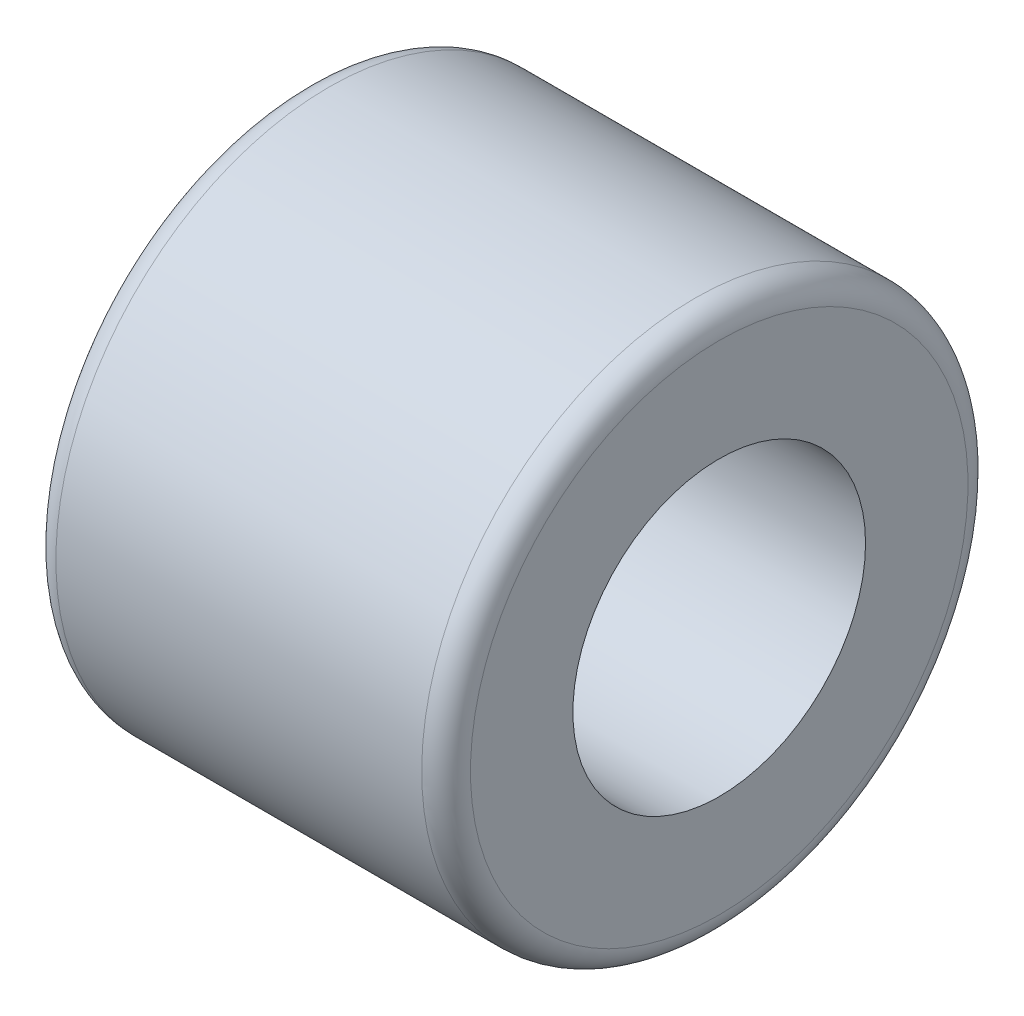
SolidWorks part; units mm, degrees
ref_plane "Plan de face" through (0, 0, 0) normal (0, 0, 1) x (1, 0, 0)
ref_plane "Plan de dessus" through (0, 0, 0) normal (0, 1, 0) x (1, 0, 0)
ref_plane "Plan de droite" through (0, 0, 0) normal (1, 0, 0) x (0, 0, -1)
sketch "Esquisse1" plane through (0, 0, 0) normal (0, 0, 1) x (1, 0, 0)
  line L0 (-7.3204, 0) -> (-7.3204, 5.6)
  line L1 (-7.3204, 5.6) -> (1.1796, 5.6)
  line L2 (1.1796, 5.6) -> (1.1796, 0)
  line L3 (1.1796, 0) -> (-7.3204, 0)
  dimension "D1" = 8.5
  dimension "D2" = 5.6
revolve "Révolution1" add sketch "Esquisse1" angle 360 about L3
sketch "Esquisse4" plane through (1.1796, 0, 0) normal (1, 0, 0) x (0, 0, -1)
  circle A0 centre (0, 0) radius 3
  dimension "D1" = 6
extrude "Enlèv. mat.-Extru.1" cut sketch "Esquisse4" against normal blind 16
fillet "Congé1" radius 0.5 2 edges at (-7.3204, 5.6, 0) (1.1796, 5.6, 0)
